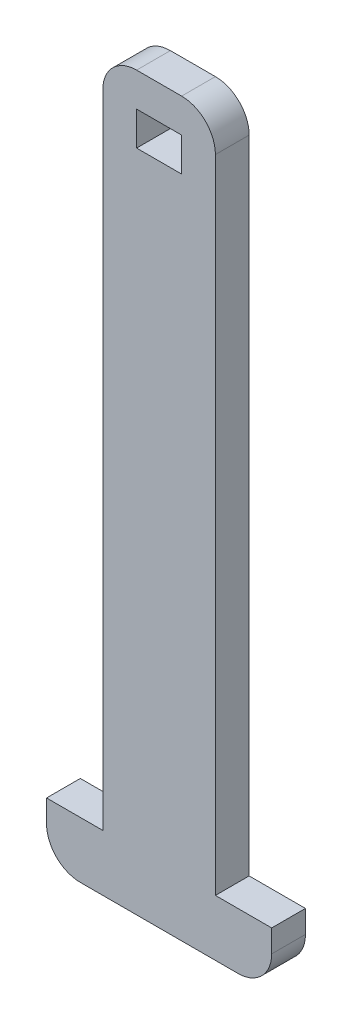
SolidWorks part; units mm, degrees
ref_plane "Front" through (0, 0, 0) normal (0, 0, 1) x (1, 0, 0)
ref_plane "Top" through (0, 0, 0) normal (0, 1, 0) x (1, 0, 0)
ref_plane "Right" through (0, 0, 0) normal (1, 0, 0) x (0, 0, -1)
sketch "草图1" plane through (0, 0, 0) normal (0, 0, 1) x (1, 0, 0)
  line L0 (0, 21.1029) -> (0, -38.8971)
  line L1 (0, -38.8971) -> (-5, -38.8971)
  line L2 (-5, -38.8971) -> (-5, -43.8971)
  line L3 (-5, -43.8971) -> (15, -43.8971)
  line L4 (15, -43.8971) -> (15, -38.8971)
  line L5 (15, -38.8971) -> (10, -38.8971)
  line L6 (10, -38.8971) -> (10, 21.1029)
  line L7 (10, 21.1029) -> (0, 21.1029)
  line L8 (3, 18.1029) -> (3, 15.1029)
  line L9 (3, 15.1029) -> (7, 15.1029)
  line L10 (7, 15.1029) -> (7, 18.1029)
  line L11 (7, 18.1029) -> (3, 18.1029)
  point P13 (5, -43.8971)
  point P14 (0, 0)
  dimension "D1" = 10
  dimension "D2" = 20
  dimension "D3" = 60
  dimension "D4" = 5
  dimension "D5" = 54
  dimension "D6" = 65
  dimension "D7" = 3
  dimension "D8" = 4
  dimension "D9" = 3
  dimension "D10" = 5
extrude "凸台-拉伸1" add sketch "草图1" along normal blind 3
fillet "圆角1" radius 3 4 edges at (-5, -43.8971, 1.5) (15, -43.8971, 1.5) (10, 21.1029, 1.5) (0, 21.1029, 1.5)
